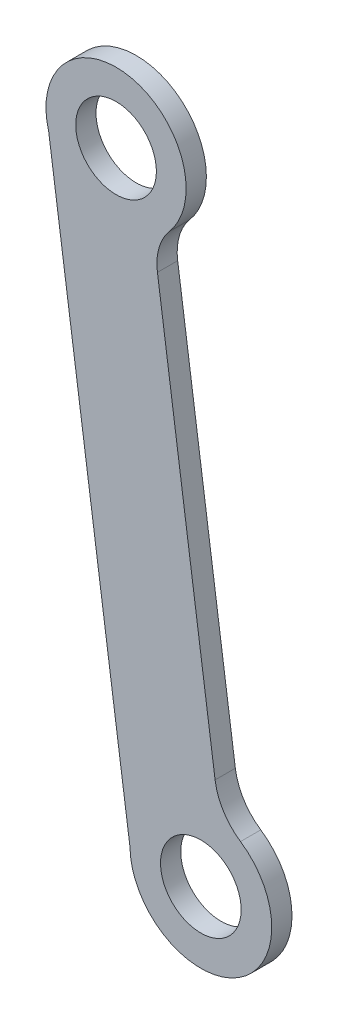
SolidWorks part; units mm, degrees
ref_plane "Plan1" through (0, 0, 0) normal (0, 0, 1) x (1, 0, 0)
ref_plane "Plan2" through (0, 0, 0) normal (0, 1, 0) x (1, 0, 0)
ref_plane "Plan3" through (0, 0, 0) normal (1, 0, 0) x (0, 0, -1)
mirrored part "biellette-D-"
